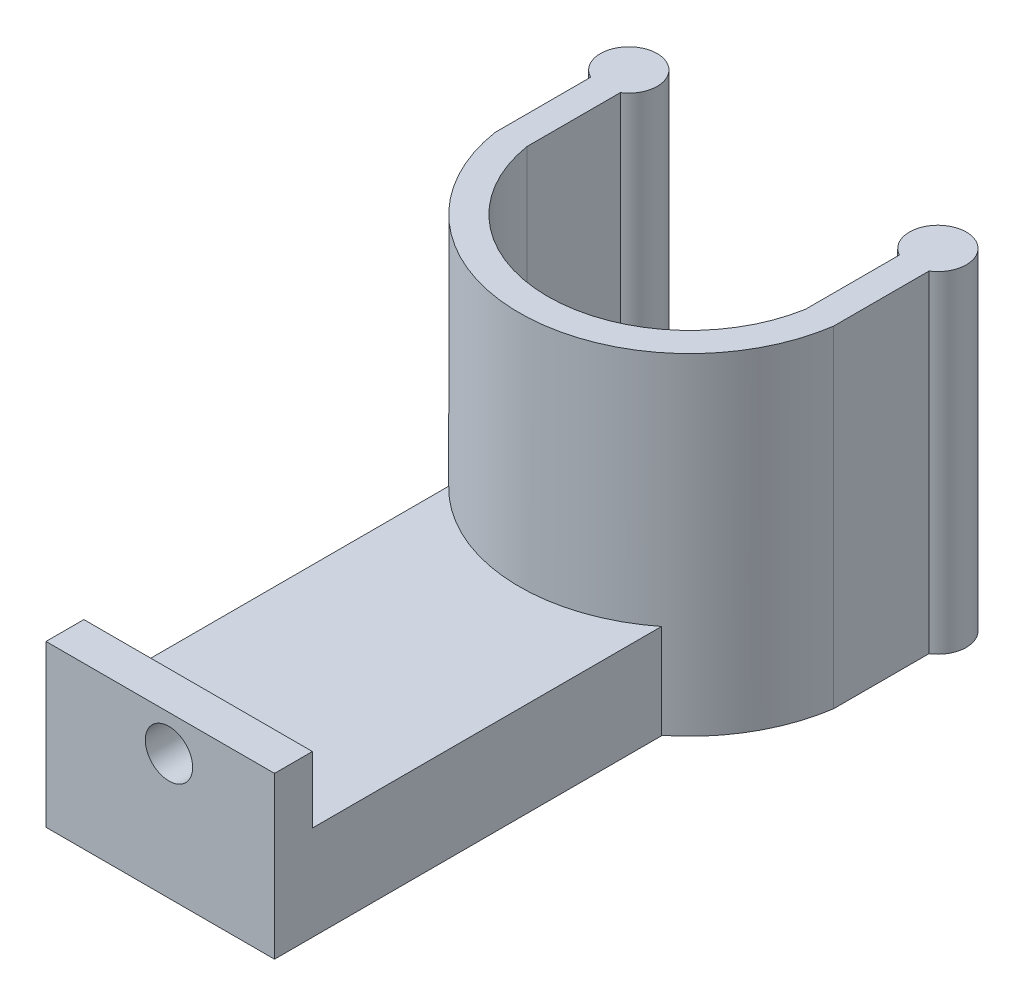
SolidWorks part; units mm, degrees
ref_plane "Front Plane" through (0, 0, 0) normal (0, 0, 1) x (1, 0, 0)
ref_plane "Top Plane" through (0, 0, 0) normal (0, 1, 0) x (1, 0, 0)
ref_plane "Right Plane" through (0, 0, 0) normal (1, 0, 0) x (0, 0, -1)
sketch "Sketch1" plane through (0, 0, 0) normal (0, 1, 0) x (1, 0, 0)
  line L2 (-17.7847, -2.7757) -> (-17.7847, 7.3203)
  line L3 (-14.8111, -2.3731) -> (-14.8111, 7.4787)
  line L4 (14.7811, -2.553) -> (14.7811, 7.3605)
  line L5 (17.8074, -2.6258) -> (17.8074, 7.4632)
  arc A0 (14.7811, -2.553) -> (-14.8111, -2.3731) centre (0, 0) cw
  arc A1 (17.8074, -2.6258) -> (-17.7847, -2.7757) centre (0, 0) cw
  arc A2 (-14.8111, 7.4787) -> (-17.7847, 7.3203) centre (-16.4364, 10.0003) ccw
  arc A3 (17.8074, 7.4632) -> (14.7811, 7.3605) centre (16.2064, 10.0003) ccw
extrude "Boss-Extrude1" add sketch "Sketch1" along normal blind 35
ref_plane "Plane1" through (0, 0, 17.9998) normal (0, 0, 1) x (1, 0, 0)
ref_plane "Plane2" through (0, 0, 50.9998) normal (0, 0, 1) x (1, 0, 0)
sketch "Sketch3" plane through (0, 0, 50.9998) normal (0, 0, 1) x (1, 0, 0)
  line L1 (-12.9214, 9.956) -> (11.1488, 9.956)
  line L2 (-12.9214, 9.956) -> (-12.9214, -0.044)
  line L3 (-12.9214, -0.044) -> (11.1488, -0.044)
  line L4 (11.1488, 9.956) -> (11.1488, -0.044)
extrude "Boss-Extrude3" add sketch "Sketch3" against normal up to surface (36.8682 mm away)
sketch "Sketch5" plane through (0, 0, 50.9998) normal (0, 0, 1) x (1, 0, 0)
  line L1 (11.1488, -0.044) -> (-12.986, -0.044)
  line L2 (11.1488, -0.044) -> (11.1488, 16.956)
  line L3 (11.1488, 16.956) -> (-12.986, 16.956)
  line L4 (-12.986, -0.044) -> (-12.986, 16.956)
extrude "Boss-Extrude4" add sketch "Sketch5" along normal blind 4
sketch "Sketch2" plane through (0, 0, 0) normal (0, -1, 0) x (1, 0, 0)
  line L1 (-27.7623, 21.3598) -> (27.7116, 21.3598)
  line L2 (-27.7623, 21.3598) -> (-27.7623, -15.3438)
  line L3 (-27.7623, -15.3438) -> (27.7116, -15.3438)
  line L4 (27.7116, 21.3598) -> (27.7116, -15.3438)
ref_plane "Plane3" through (-12.986, -0.044, 50.9998) normal (0, 0, -1) x (-1, 0, 0)
sketch "Sketch9" plane through (0, 0, 50.9998) normal (0, 0, -1) x (-1, 0, 0)
  circle A0 centre (0, 13.1828) radius 2.5
extrude "Cut-Extrude2" cut sketch "Sketch9" against normal blind 4
extrude "Boss-Extrude2" add sketch "Sketch2" against normal blind 0.3
